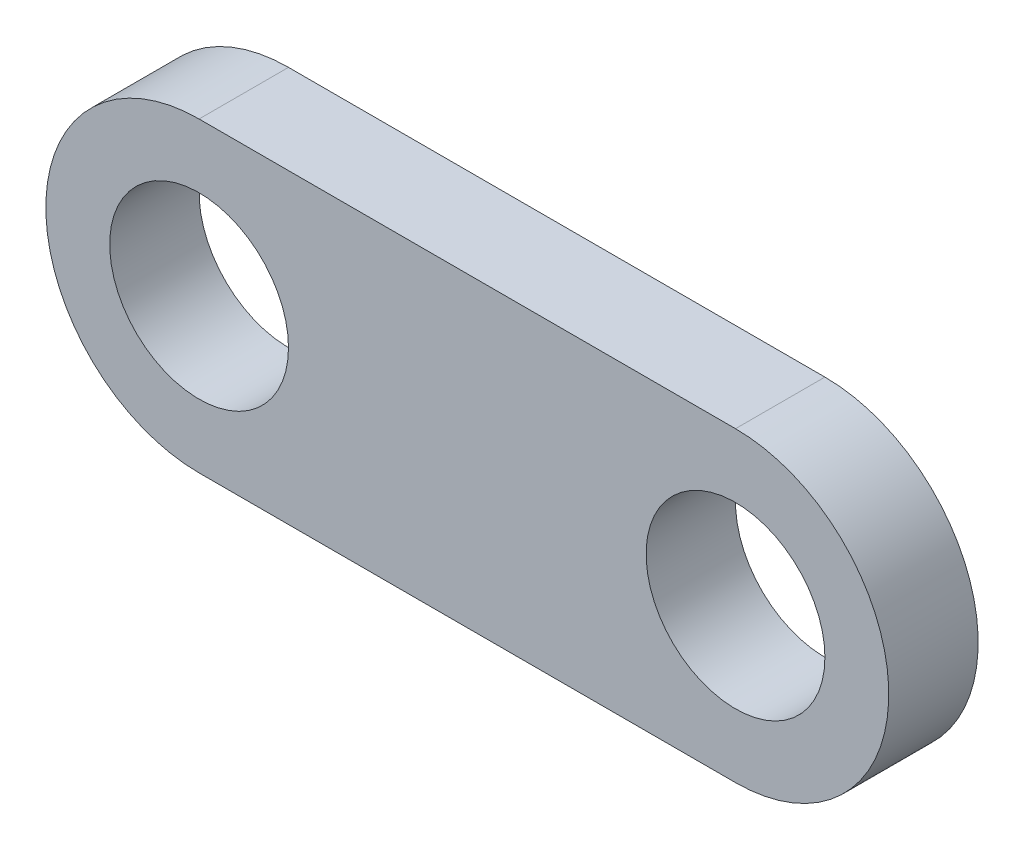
SolidWorks part; units mm, degrees
ref_plane "Plan de face" through (0, 0, 0) normal (0, 0, 1) x (1, 0, 0)
ref_plane "Plan de dessus" through (0, 0, 0) normal (0, 1, 0) x (1, 0, 0)
ref_plane "Plan de droite" through (0, 0, 0) normal (1, 0, 0) x (0, 0, -1)
ref_plane "Plan4" through (0, 0, 0) normal (0, 0, -1) x (-1, 0, 0)
sketch "Esquisse1" plane through (0, 0, 0) normal (0, 0, -1) x (-1, 0, 0)
  line L0 (0, 12) -> (-42, 12)
  line L1 (-42, -12) -> (0, -12)
  circle A0 centre (-42, 0) radius 7
  circle A1 centre (0, 0) radius 7
  arc A2 (0, -12) -> (0, 12) centre (0, 0) ccw
  arc A3 (-42, 12) -> (-42, -12) centre (-42, 0) ccw
extrude "Extrusion1" add sketch "Esquisse1" against normal blind 7
